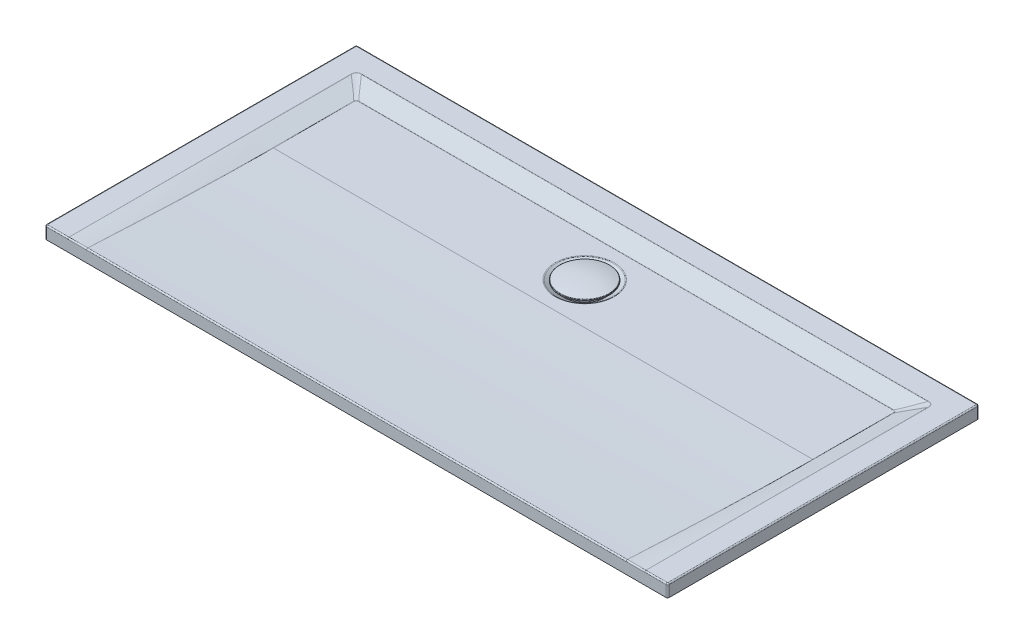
SolidWorks part; units mm, degrees
ref_plane "Płaszczyzna przednia" through (0, 0, 0) normal (0, 0, 1) x (1, 0, 0)
ref_plane "Płaszczyzna górna" through (0, 0, 0) normal (0, 1, 0) x (1, 0, 0)
ref_plane "Płaszczyzna prawa" through (0, 0, 0) normal (1, 0, 0) x (0, 0, -1)
sketch "Szkic1" plane through (0, 0, 0) normal (0, 1, 0) x (1, 0, 0)
  line L0 (0, 375) -> (0, -375) construction
  line L1 (-750, 375) -> (750, 375)
  line L2 (-750, 375) -> (-750, -375)
  line L3 (-750, -375) -> (750, -375)
  line L4 (750, 375) -> (750, -375)
  line L5 (-695, -375) -> (-695, 320)
  line L6 (-695, 320) -> (695, 320)
  line L7 (695, 320) -> (695, -375)
  line L8 (-650, -375) -> (-650, 275)
  line L9 (-650, 275) -> (650, 275)
  line L10 (650, 275) -> (650, -375)
  circle A0 centre (0, 175) radius 45
  circle A1 centre (0, 175) radius 70
  point P9 (0, 320)
  dimension "D6" = 90
  dimension "D7" = 140
  dimension "D1" = 1500
  dimension "D2" = 55
  dimension "D3" = 55
  dimension "D5" = 200
  dimension "D8" = 750
  dimension "D4" = 45
sketch "Szkic2" plane through (0, 0, 0) normal (0, 1, 0) x (1, 0, 0)
  line L0 (-750, -375) -> (750, -375) construction
  line L1 (750, 375) -> (750, -375) construction
  line L2 (695, 320) -> (695, -375) construction
  line L3 (-695, 320) -> (695, 320) construction
  line L4 (-750, 375) -> (750, 375) construction
  line L5 (-695, -375) -> (-695, 320) construction
  line L6 (-750, 375) -> (-750, -375) construction
  line L7 (-750, -375) -> (-695, -375)
  line L8 (750, 375) -> (750, -375)
  line L9 (695, 320) -> (695, -375)
  line L10 (-695, 320) -> (695, 320)
  line L11 (-750, 375) -> (750, 375)
  line L12 (-695, -375) -> (-695, 320)
  line L13 (-750, 375) -> (-750, -375)
  line L14 (695, -375) -> (750, -375)
surface "Powierzchnia-Płaszczyzna1" sketch "Szkic2"
ref_plane "Płaszczyzna1" through (0, -15, 0) normal (0, 1, 0) x (-1, 0, 0)
sketch "Szkic3" plane through (0, -15, 0) normal (0, 1, 0) x (-1, 0, 0)
  line L0 (650, -75) -> (-650, -75)
  line L1 (650, 375) -> (650, -275) construction
  line L2 (-650, -275) -> (-650, 375) construction
  line L3 (0, -75) -> (0, -275) construction
  line L4 (650, -275) -> (-650, -275) construction
  line L5 (-650, -275) -> (-650, -75)
  line L6 (650, -75) -> (650, -275)
  line L7 (650, -275) -> (-650, -275)
  circle A0 centre (0, -175) radius 70 construction
  circle A1 centre (0, -175) radius 70
  point P10 (0, -175)
surface "Powierzchnia-Płaszczyzna2" sketch "Szkic3"
sketch "Szkic4" plane through (0, 0, 0) normal (0, 1, 0) x (1, 0, 0)
  line L0 (650, -375) -> (-650, -375)
other "Granica-Powierzchnia1"
other "Granica-Powierzchnia2"
other "Granica-Powierzchnia3"
mirror "Lustro1" about plane through (0, 0, 0) normal (1, 0, 0)
sketch "Szkic5" plane through (0, 0, 0) normal (0, 1, 0) x (1, 0, 0)
  line L0 (750, 375) -> (750, -375) construction
  line L1 (-750, 375) -> (750, 375) construction
  line L2 (-750, 375) -> (-750, -375) construction
  line L3 (-750, -375) -> (750, -375) construction
  line L4 (750, 375) -> (750, -375)
  line L5 (-750, 375) -> (750, 375)
  line L6 (-750, 375) -> (-750, -375)
  line L7 (-750, -375) -> (750, -375)
surface "Powierzchnia-Wyciągnięcie1" sketch "Szkic5" parameters "D1"=30
sketch "Szkic7" plane through (0, 0, 0) normal (1, 0, 0) x (0, 0, -1)
  line L0 (175, 0) -> (175, -30) construction
  line L1 (375, -30) -> (-375, -30) construction
  line L2 (220, -30) -> (220, -28)
  line L3 (220, -28) -> (224, -28)
  line L6 (224, -28) -> (245, -15)
  dimension "D1" = 90
  dimension "D2" = 2
  dimension "D3" = 98
surface "Powierzchnia-Obrót wokół linii środkowej1" sketch "Szkic7" parameters "D1"=360
surface "Powierzchnia-Płaszczyzna3"
surface "Powierzchnia-Połącz1"
fillet "Zaokrąglenie1" radius 4 6 edges at (0, -28, -224) (0, -15, -105) (750, -15, 375) (750, -15, -375) (-750, -15, -375) (-750, -15, 375)
fillet "Zmienne zaokrąglenie1" radius 40 2 edges at (672.5, -7.5, -297.5)
fillet "Zaokrąglenie3" radius 3 12 edges
fillet "Zaokrąglenie4" radius 3 12 edges at (-748.8284, 0, -373.8284) (0, 0, -375) (748.8284, 0, -373.8284) (750, 0, 0) (748.8284, 0, 373.8284) (720.5, 0, 375) (-720.5, 0, 375) (-748.8284, 0, 373.8284) (-750, 0, 0)
sketch "Szkic8" plane through (0, 0, 0) normal (1, 0, 0) x (0, 0, -1)
  line L0 (175, 0) -> (175, -30) construction
  line L1 (175, -5.6601) -> (179.8469, -5.6601) construction
  line L2 (235, -14.7573) -> (235, -17)
  line L3 (235, -17) -> (175, -17)
  line L4 (175, -17) -> (175, -5.6601)
  line L5 (175, -5.6601) -> (199.9922, 95.6514)
  arc A0 (175, -5.6601) -> (234.2694, -13.7943) centre (175, -225.6601) cw
  arc A1 (234.2694, -13.7943) -> (235, -14.7573) centre (234, -14.7573) cw
  point P11 (235, -14)
  dimension "D1" = 220
  dimension "D4" = 1
  dimension "D2" = 60
  dimension "D3" = 3
  dimension "D5" = 13
revolve "Obrót wokół linii środkowej1" add sketch "Szkic8" angle 360 about L4
